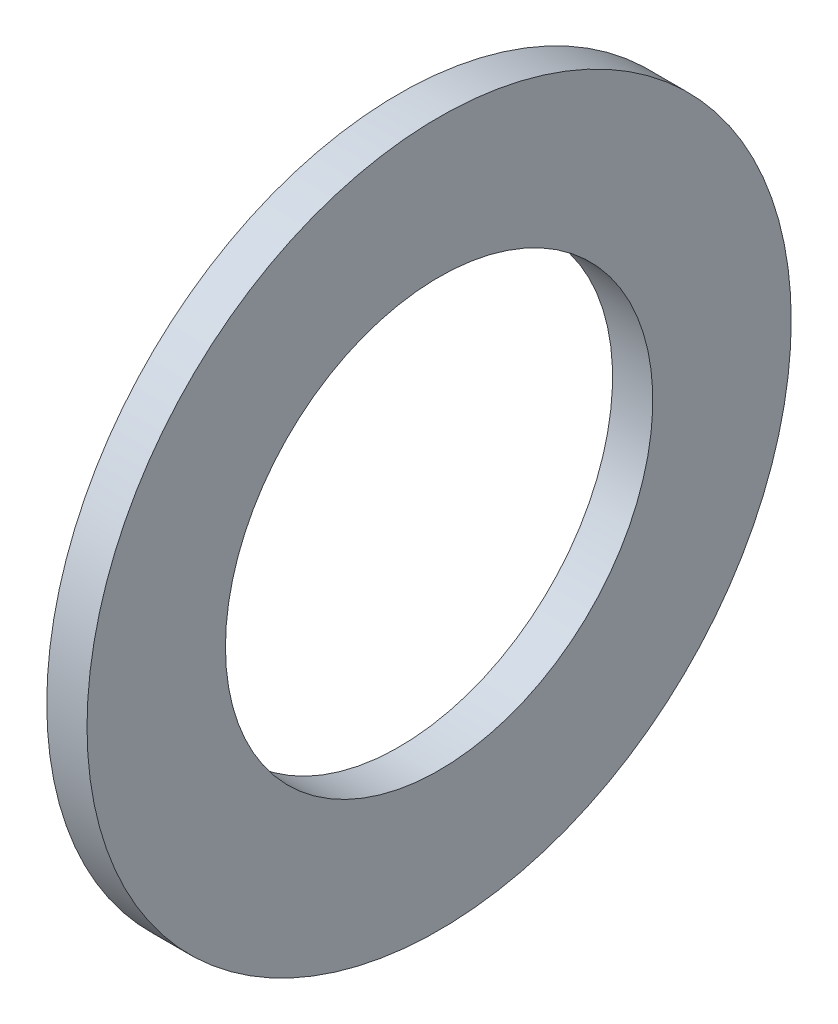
SolidWorks part; units mm, degrees
ref_plane "Plane1" through (0, 0, 0) normal (0, 0, 1) x (1, 0, 0)
ref_plane "Plane2" through (0, 0, 0) normal (0, 1, 0) x (1, 0, 0)
ref_plane "Plane3" through (0, 0, 0) normal (1, 0, 0) x (0, 0, -1)
other "Configuration Table"
sketch "Sketch1" plane through (0, 0, 0) normal (0, 0, 1) x (1, 0, 0)
  line L0 (-34.925, 0) -> (9.525, 0) construction
  line L1 (0, 13.4874) -> (0, 22.225)
  line L2 (0, 22.225) -> (-2.54, 22.225)
  line L3 (-2.54, 22.225) -> (-2.54, 13.4874)
  line L4 (-2.54, 13.4874) -> (0, 13.4874)
  dimension "Thickness" = 2.54
  dimension "Inside_dia" = 26.9748
  dimension "Outside_dia" = 44.45
revolve "Base-Revolve" add sketch "Sketch1" angle 360 about L0
